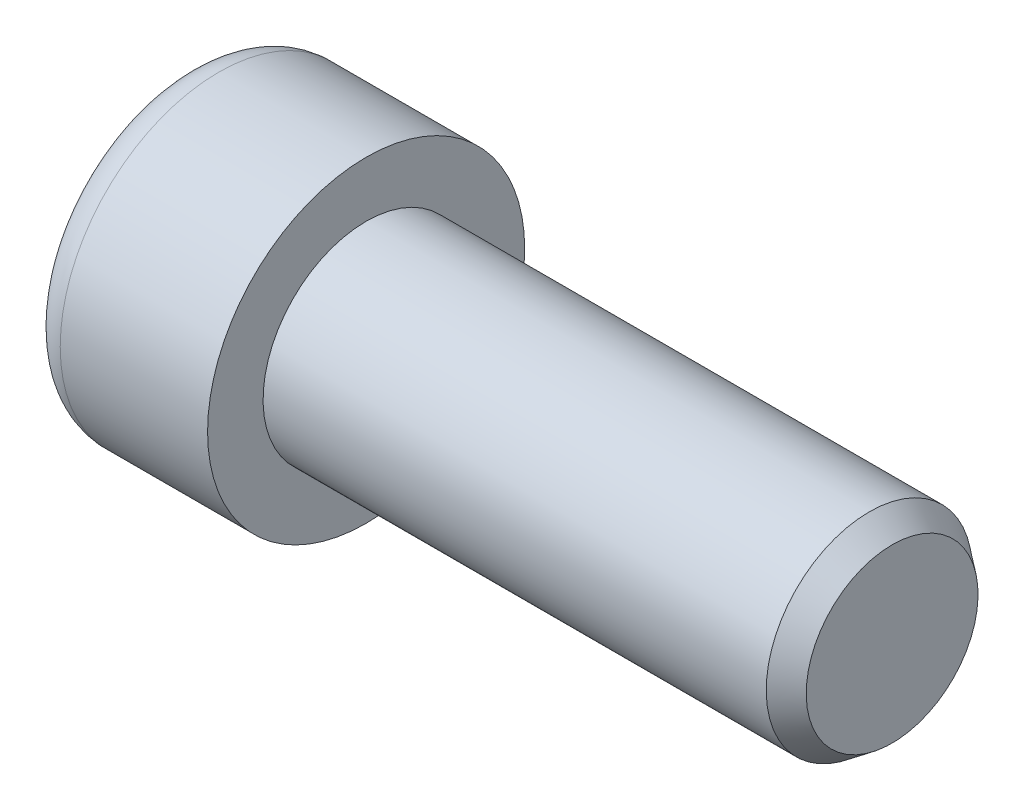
SolidWorks part; units mm, degrees
ref_plane "Plan de face" through (0, 0, 0) normal (0, 0, 1) x (1, 0, 0)
ref_plane "Plan de dessus" through (0, 0, 0) normal (0, 1, 0) x (1, 0, 0)
ref_plane "Plan de droite" through (0, 0, 0) normal (1, 0, 0) x (0, 0, -1)
sketch "Esquisse1" plane through (0, 331.1638, 486.5445) normal (0, -0.2629, -0.9648) x (1, 0, 0)
  line L0 (-255.51, 66.1101) -> (-283.2286, 66.1101) construction
  line L2 (-260.2006, 66.1101) -> (-260.2006, 68.6107)
  line L3 (-260.2006, 68.6107) -> (-260.8648, 69.1101)
  line L5 (-260.8648, 69.1101) -> (-275.51, 69.1101)
  line L7 (-275.51, 69.1101) -> (-275.51, 70.7252)
  line L8 (-275.51, 70.7252) -> (-280.7989, 70.7252)
  line L9 (-280.7989, 70.7252) -> (-280.7989, 66.1101)
  line L10 (-260.2006, 66.1101) -> (-280.7989, 66.1101)
  dimension "D1" = 3
  dimension "D2" = 15.3095
  dimension "D3" = 5.2889
  dimension "D4" = 4.6151
revolve "Révolution1" add sketch "Esquisse1" angle 360 about L0
sketch "Esquisse2" plane through (-280.7989, 0, 0) normal (-1, 0, 0) x (0, 0, 1)
  line L1 (506.1518, 267.9796) -> (504.5163, 269.6101)
  line L2 (504.5163, 269.6101) -> (502.2865, 269.0089)
  line L3 (502.2865, 269.0089) -> (501.6922, 266.7772)
  line L4 (501.6922, 266.7772) -> (503.3278, 265.1468)
  line L5 (503.3278, 265.1468) -> (505.5575, 265.748)
  line L6 (505.5575, 265.748) -> (506.1518, 267.9796)
  circle A0 centre (503.922, 267.3784) radius 2 construction
  dimension "D1" = 4
extrude "Enlèv. mat.-Extru.1" cut sketch "Esquisse2" against normal blind 3
fillet "Congé1" radius 1 1 edges at (-280.7989, 271.9935, 503.922)
